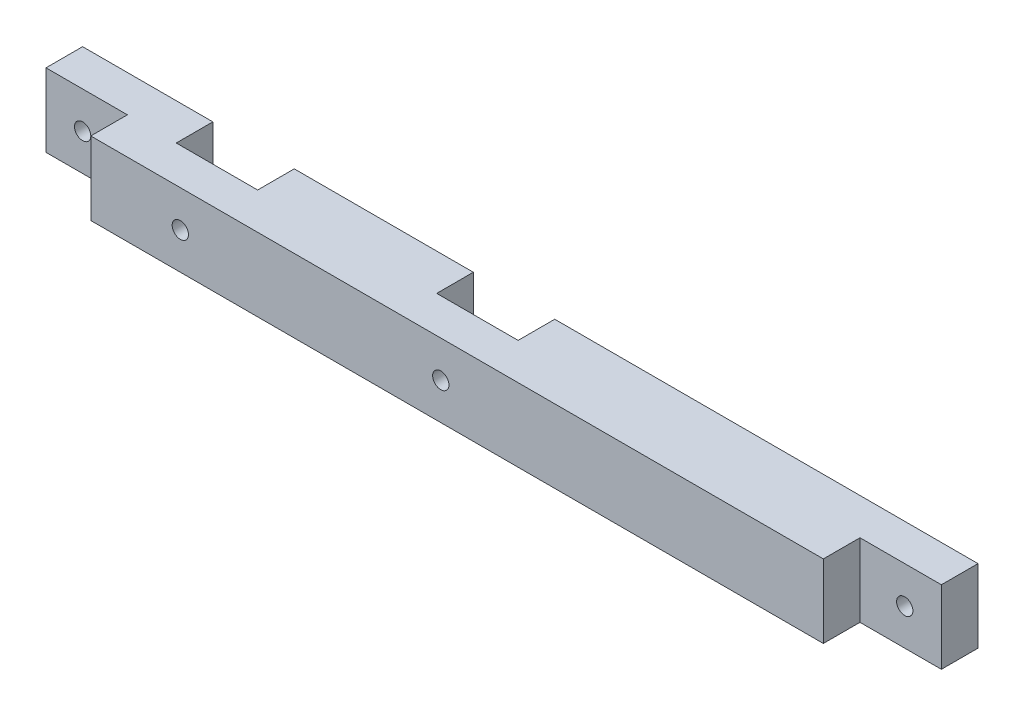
SolidWorks part; units mm, degrees
ref_plane "Face" through (0, 0, 0) normal (0, 0, 1) x (1, 0, 0)
ref_plane "Dessus" through (0, 0, 0) normal (0, 1, 0) x (1, 0, 0)
ref_plane "Droite" through (0, 0, 0) normal (1, 0, 0) x (0, 0, -1)
sketch "Esquisse1" plane through (0, 0, 0) normal (0, 0, 1) x (1, 0, 0)
  line L1 (-67.2717, -109.6176) -> (42.7283, -109.6176)
  line L2 (-67.2717, -109.6176) -> (-67.2717, -100.6176)
  line L3 (-67.2717, -100.6176) -> (42.7283, -100.6176)
  line L4 (42.7283, -109.6176) -> (42.7283, -100.6176)
  dimension "D1" = 110
  dimension "D2" = 9
extrude "Extrusion1" add sketch "Esquisse1" along normal blind 9
sketch "Esquisse2" plane through (0, 0, 9) normal (0, 0, 1) x (1, 0, 0)
  line L0 (42.7283, -100.6176) -> (-67.2717, -100.6176) construction
  line L1 (-67.2717, -109.6176) -> (-57.2717, -109.6176)
  line L2 (-67.2717, -109.6176) -> (-67.2717, -100.6176)
  line L3 (-67.2717, -100.6176) -> (-57.2717, -100.6176)
  line L4 (-57.2717, -109.6176) -> (-57.2717, -100.6176)
  line L6 (42.7283, -109.6176) -> (32.7283, -109.6176)
  line L7 (42.7283, -109.6176) -> (42.7283, -100.6176)
  line L8 (42.7283, -100.6176) -> (32.7283, -100.6176)
  line L9 (32.7283, -109.6176) -> (32.7283, -100.6176)
  dimension "D1" = 10
  dimension "D2" = 10
extrude "Enlèv. mat.-Extru.1" cut sketch "Esquisse2" against normal blind 4.5
sketch "Esquisse4" plane through (0, 0, 4.5) normal (0, 0, 1) x (1, 0, 0)
  line L0 (42.7283, -109.6176) -> (42.7283, -100.6176) construction
  line L1 (32.7283, -109.6176) -> (42.7283, -109.6176) construction
  circle A0 centre (38.2284, -105.1454) radius 1
  point P2 (42.7283, -105.1176)
  point P5 (37.7283, -109.6176)
  dimension "D3" = 2
  dimension "D1" = 4.5
  dimension "D2" = 4.5
extrude "Enlèv. mat.-Extru.2" cut sketch "Esquisse4" against normal blind 4.5
sketch "Esquisse5" plane through (0, 0, 4.5) normal (0, 0, 1) x (1, 0, 0)
  line L0 (-67.2717, -109.6176) -> (-57.2717, -109.6176) construction
  line L1 (-67.2717, -100.6176) -> (-67.2717, -109.6176) construction
  circle A0 centre (-62.7717, -105.1176) radius 1
  dimension "D1" = 2
  dimension "D2" = 4.5
  dimension "D3" = 4.5
extrude "Enlèv. mat.-Extru.3" cut sketch "Esquisse5" against normal blind 4.5
sketch "Esquisse6" plane through (0, 0, 0) normal (0, 0, -1) x (-1, 0, 0)
  line L0 (-42.7283, -100.6176) -> (67.2717, -100.6176) construction
  line L1 (51.2717, -100.6176) -> (41.2717, -100.6176)
  line L2 (51.2717, -100.6176) -> (51.2717, -109.6176)
  line L3 (51.2717, -109.6176) -> (41.2717, -109.6176)
  line L4 (41.2717, -100.6176) -> (41.2717, -109.6176)
  line L5 (67.2717, -109.6176) -> (-42.7283, -109.6176) construction
  line L7 (19.2717, -100.6176) -> (9.2717, -100.6176)
  line L8 (19.2717, -100.6176) -> (19.2717, -109.6176)
  line L9 (19.2717, -109.6176) -> (9.2717, -109.6176)
  line L10 (9.2717, -100.6176) -> (9.2717, -109.6176)
  dimension "D1" = 10
  dimension "D2" = 10
  dimension "D3" = 22
  dimension "D4" = 16
extrude "Enlèv. mat.-Extru.4" cut sketch "Esquisse6" against normal blind 4.5
sketch "Esquisse7" plane through (0, 0, 4.5) normal (0, 0, -1) x (-1, 0, 0)
  line L0 (9.2717, -109.6176) -> (19.2717, -109.6176) construction
  line L1 (19.2717, -109.6176) -> (19.2717, -100.6176) construction
  circle A0 centre (14.2717, -105.1176) radius 1
  dimension "D3" = 2
  dimension "D1" = 4.5
  dimension "D2" = 5
extrude "Enlèv. mat.-Extru.5" cut sketch "Esquisse7" against normal blind 4.5
sketch "Esquisse8" plane through (0, 0, 4.5) normal (0, 0, -1) x (-1, 0, 0)
  line L0 (51.2717, -109.6176) -> (51.2717, -100.6176) construction
  line L1 (41.2717, -109.6176) -> (51.2717, -109.6176) construction
  circle A0 centre (46.2717, -105.1176) radius 1
  dimension "D3" = 2
  dimension "D1" = 5
  dimension "D2" = 4.5
extrude "Enlèv. mat.-Extru.6" cut sketch "Esquisse8" against normal blind 4.5
